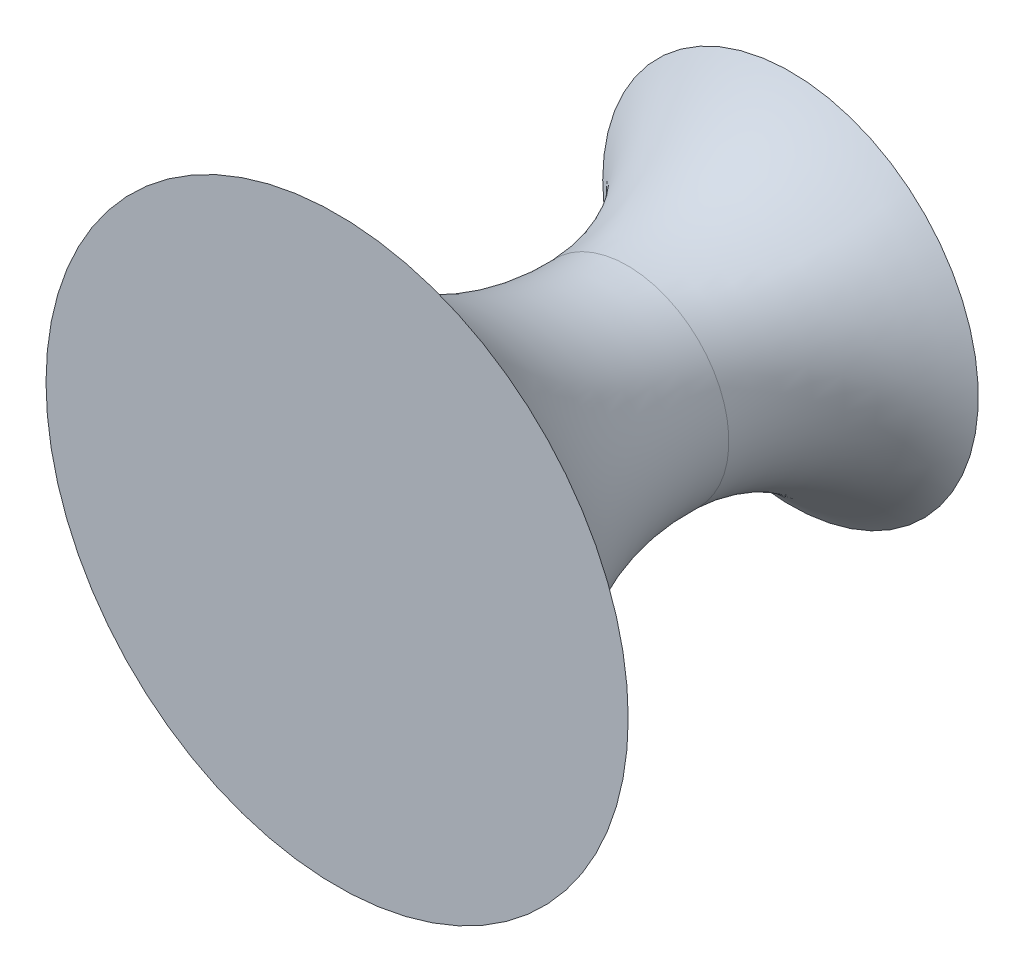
SolidWorks part; units mm, degrees
ref_plane "前视基准面" through (0, 0, 0) normal (0, 0, 1) x (1, 0, 0)
ref_plane "上视基准面" through (0, 0, 0) normal (0, 1, 0) x (1, 0, 0)
ref_plane "右视基准面" through (0, 0, 0) normal (1, 0, 0) x (0, 0, -1)
sketch "草图1" plane through (0, 0, 0) normal (0, 1, 0) x (1, 0, 0)
  line L0 (0, 82.1765) -> (0, -86.6588) construction
  line L1 (0, 56.7765) -> (-40, 56.7765)
  line L2 (-62, -39.7812) -> (0, -39.7812)
  line L3 (0, 56.7765) -> (0, -39.7812)
  arc A0 (-40, 56.7765) -> (-21.6251, 22.0211) centre (-66.5986, 20.4789) cw
  arc A1 (-21.6251, 22.0211) -> (-62, -39.7812) centre (-85.7476, 19.8223) cw
  dimension "D3" = 45
  dimension "D1" = 62
  dimension "D2" = 40
revolve "旋转1" add sketch "草图1" angle 360 about L0
sketch "草图2" plane through (0, 0, 0) normal (0, 0, 1) x (1, 0, 0)
  line L1 (-29.0002, 78.5631) -> (-89.0002, 78.5631)
  line L2 (-29.0002, 78.5631) -> (-29.0002, -78.5631)
  line L3 (-29.0002, -78.5631) -> (-89.0002, -78.5631)
  line L4 (-89.0002, 78.5631) -> (-89.0002, -78.5631)
extrude "切除-拉伸1" [suppressed] cut sketch "草图2" against normal mid plane 150
